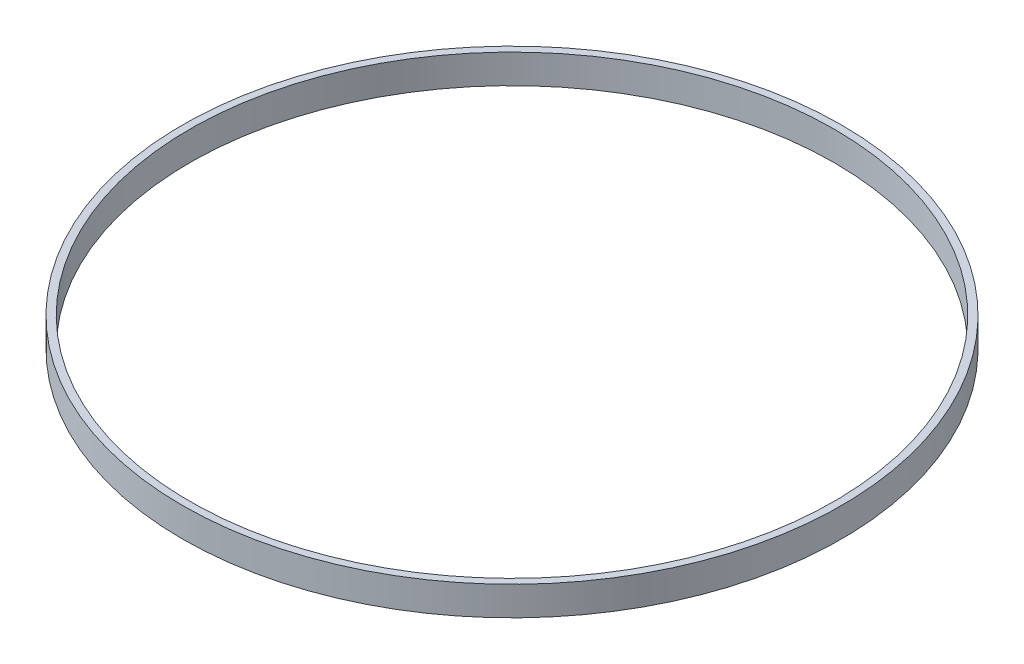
SolidWorks part; units mm, degrees
ref_plane "Front Plane" through (0, 0, 0) normal (0, 0, 1) x (1, 0, 0)
ref_plane "Top Plane" through (0, 0, 0) normal (0, 1, 0) x (1, 0, 0)
ref_plane "Right Plane" through (0, 0, 0) normal (1, 0, 0) x (0, 0, -1)
sketch "Sketch1" plane through (0, 0, 0) normal (0, 0, 1) x (1, 0, 0)
  line L0 (0, 0) -> (0, 29.1328) construction
  line L1 (-215.9, 0) -> (-211.1375, 0)
  line L2 (-215.9, 0) -> (-215.9, 19.05)
  line L3 (-215.9, 19.05) -> (-211.1375, 19.05)
  line L4 (-211.1375, 0) -> (-211.1375, 19.05)
  dimension "D1" = 4.7625
  dimension "D2" = 19.05
  dimension "D3" = 431.8
revolve "Revolve1" add sketch "Sketch1" angle 360 about L0
sketch "Sketch2" plane through (0, 0, 0) normal (0, 0, 1) x (1, 0, 0)
  line L1 (-215.9, 19.05) -> (-194.36, 16.3224)
  line L2 (-194.36, 16.3224) -> (-194.2849, 16.9159)
  line L3 (-194.2849, 16.9159) -> (-211.1375, 19.05)
  line L4 (215.9, 19.05) -> (-215.9, 19.05) construction
  line L6 (0, 0) -> (0, 43.447) construction
  line L7 (-211.1375, 19.05) -> (-211.1375, 0) construction
  line L8 (-215.9, 19.05) -> (-211.1375, 19.05)
revolve "Revolve2" [suppressed] add sketch "Sketch2" angle 360 about L6
